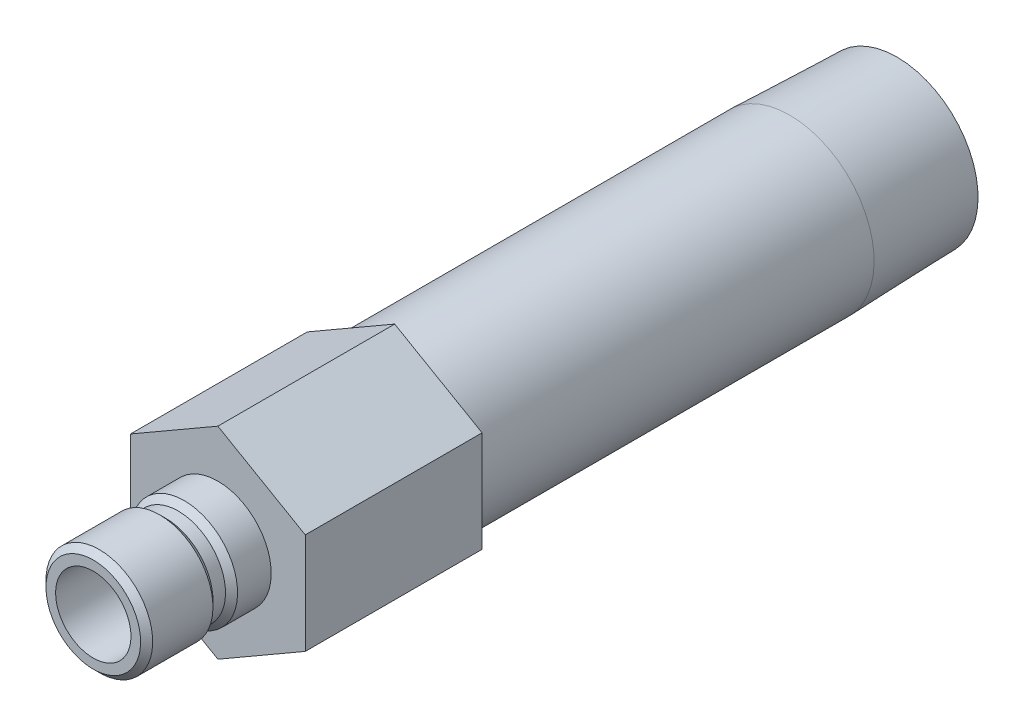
SolidWorks part; units mm, degrees
ref_plane "Front Plane" through (0, 0, 0) normal (0, 0, 1) x (1, 0, 0)
ref_plane "Top Plane" through (0, 0, 0) normal (0, 1, 0) x (1, 0, 0)
ref_plane "Right Plane" through (0, 0, 0) normal (1, 0, 0) x (0, 0, -1)
sketch "Sketch1" plane through (0, 0, 0) normal (1, 0, 0) x (0, 0, -1)
  line L0 (0, 0) -> (-18.923, 0) construction
  line L1 (-15.748, 4.7625) -> (-15.748, 5.9817)
  line L2 (-6.604, 5.9817) -> (-6.604, 0) construction
  line L3 (-14.986, 6.7437) -> (-7.366, 6.7437)
  line L4 (0, 10.668) -> (0, 0) construction
  line L5 (-6.604, 5.9817) -> (-5.0165, 5.9817)
  line L6 (-4.2545, 6.7437) -> (0, 6.7437)
  line L7 (0, 6.7437) -> (0, 10.668)
  line L8 (-6.604, 5.9817) -> (-7.366, 6.7437)
  line L9 (-5.0165, 5.9817) -> (-4.2545, 6.7437)
  line L10 (-15.748, 5.9817) -> (-14.986, 6.7437)
  line L11 (-15.748, 4.7625) -> (22.352, 4.7625)
  line L12 (0, 10.668) -> (72.2884, 10.668)
  line L13 (72.2884, 10.668) -> (85.852, 10.2441)
  line L14 (85.852, 10.2441) -> (85.852, 7.8994)
  line L15 (0, 6.7437) -> (22.352, 6.7437) construction
  line L16 (22.352, 6.7437) -> (22.352, 0) construction
  line L17 (22.352, 0) -> (0, 0) construction
  line L18 (22.352, 4.7625) -> (22.352, 7.8994)
  line L19 (22.352, 7.8994) -> (85.852, 7.8994)
  dimension "D1" = 15.748
  dimension "D2" = 1.5875
  dimension "D3" = 0.762
  dimension "D4" = 45
  dimension "D5" = 9.144
  dimension "D6" = 45
  dimension "D7" = 1.79
  dimension "D8" = 13.5636
  dimension "D9" = 101.6
  dimension "D10" = 3.175
  dimension "D11" = 9.525
  dimension "D12" = 21.336
  dimension "D13" = 38.1
  dimension "D14" = 13.4874
  dimension "D15" = 15.7988
revolve "Revolve1" add sketch "Sketch1" angle 360 about L0
sketch "Sketch2" plane through (0, 0, 0) normal (0, 0, 1) x (1, 0, 0)
  line L1 (-11.049, 6.3791) -> (-11.049, -6.3791)
  line L2 (-11.049, -6.3791) -> (0, -12.7583)
  line L3 (0, -12.7583) -> (11.049, -6.3791)
  line L4 (11.049, -6.3791) -> (11.049, 6.3791)
  line L5 (11.049, 6.3791) -> (0, 12.7583)
  line L6 (0, 12.7583) -> (-11.049, 6.3791)
  circle A0 centre (0, 0) radius 11.049 construction
  circle A1 centre (0, 0) radius 4.7625 construction
  circle A2 centre (0, 0) radius 4.7625
  dimension "D1" = 22.098
extrude "Boss-Extrude1" add sketch "Sketch2" against normal up to vertex (22.352 mm away) from vertex at 0
